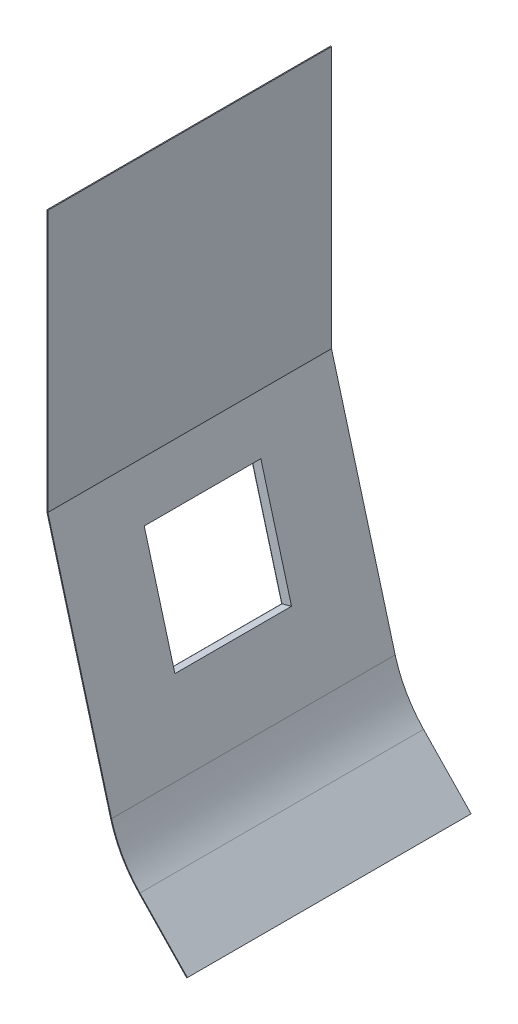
SolidWorks part; units mm, degrees
ref_plane "Front Plane" through (0, 0, 0) normal (0, 0, 1) x (1, 0, 0)
ref_plane "Top Plane" through (0, 0, 0) normal (0, 1, 0) x (1, 0, 0)
ref_plane "Right Plane" through (0, 0, 0) normal (1, 0, 0) x (0, 0, -1)
sketch "Sketch2" plane through (0, 0, 0) normal (0, 0, 1) x (1, 0, 0)
  line L0 (-1955.5772, 1359.5164) -> (-1955.5772, 2592.5164) construction
  line L1 (-1568.9554, 167.6637) -> (-1369.1254, -40.0781)
  line L3 (0, -42.8511) -> (-1372.0082, -42.8511) construction
  line L4 (-1955.5772, 1359.5164) -> (-1688.0918, 378.98)
  line L5 (-1955.5772, 2458.9806) -> (-1955.5772, 1359.5164)
  line L6 (-1959.5772, 1358.9806) -> (-1955.5772, 1359.5164) construction
  line L7 (-1959.5772, 2458.9806) -> (-1959.5772, 1358.9806)
  line L8 (-1959.5772, 1358.9806) -> (-1691.9508, 377.9273)
  line L9 (-1372.0082, -42.8511) -> (-1571.8382, 164.8907)
  line L10 (-1372.0082, -42.8511) -> (-1369.1254, -40.0781)
  line L11 (-1955.5772, 2458.9806) -> (-1959.5772, 2458.9806)
  line L12 (-1955.5772, 1359.5164) -> (-1959.5772, 1359.5164) construction
  line L13 (-1691.9508, 377.9273) -> (-1688.0918, 378.98) construction
  line L14 (-1571.8382, 164.8907) -> (-1568.9554, 167.6637) construction
  arc A0 (-1688.0918, 378.98) -> (-1568.9554, 167.6637) centre (-1209.5772, 509.5164) ccw
  arc A1 (-1691.9508, 377.9273) -> (-1571.8382, 164.8907) centre (-1209.5772, 509.5165) ccw
  point P0 (0, -40.0781)
  dimension "D2" = 1100
  dimension "D4" = 7.629
  dimension "D7" = 199.83
  dimension "D1" = 4.0357
  dimension "D5" = 4
  dimension "D8" = 500
  dimension "D6" = 28.629
  dimension "D3" = 4
extrude "Boss-Extrude2" add sketch "Sketch2" along normal blind 1192
sketch "Sketch3" plane through (-1478.8057, -403.4107, 0) normal (-0.9647, -0.2632, 0) x (0, 0, 1)
  line L0 (596, 1376.2549) -> (596, 1826.2549) construction
  line L2 (351, 1131.2549) -> (841, 1131.2549)
  line L3 (1192, 1826.2549) -> (0, 1826.2549) construction
  line L4 (351, 1131.2549) -> (351, 1621.2549)
  line L5 (351, 1621.2549) -> (841, 1621.2549)
  line L6 (841, 1131.2549) -> (841, 1621.2549)
  line L7 (351, 1131.2549) -> (841, 1621.2549) construction
  line L8 (351, 1621.2549) -> (841, 1131.2549) construction
  dimension "D1" = 490
  dimension "D2" = 450
extrude "Cut-Extrude1" cut sketch "Sketch3" against normal through all
sketch "Sketch4" plane through (-1478.8057, -403.4107, 0) normal (-0.9647, -0.2632, 0) x (0, 0, 1)
  line L0 (845, 1127.2549) -> (845, 1625.2549)
  line L1 (351, 1131.2549) -> (841, 1131.2549)
  line L2 (351, 1131.2549) -> (351, 1621.2549)
  line L3 (351, 1621.2549) -> (841, 1621.2549)
  line L4 (841, 1131.2549) -> (841, 1621.2549)
  line L5 (351, 1131.2549) -> (841, 1621.2549) construction
  line L6 (351, 1621.2549) -> (841, 1131.2549) construction
  line L7 (347, 1625.2549) -> (845, 1625.2549)
  line L8 (347, 1127.2549) -> (347, 1625.2549)
  line L9 (347, 1127.2549) -> (845, 1127.2549)
  point P0 (596, 1376.2549)
  point P5 (0, 0)
  dimension "D1" = 4
extrude "Boss-Extrude4" add sketch "Sketch4" along normal blind 42
sketch "Sketch19" plane through (-1519.3251, -414.4642, 0) normal (-0.9647, -0.2632, 0) x (0, 0, 1)
  line L0 (316, 1656.2549) -> (876, 1656.2549)
  line L1 (351, 1131.2549) -> (841, 1131.2549)
  line L2 (351, 1131.2549) -> (351, 1621.2549)
  line L3 (351, 1621.2549) -> (841, 1621.2549)
  line L4 (841, 1131.2549) -> (841, 1621.2549)
  line L5 (351, 1131.2549) -> (841, 1621.2549) construction
  line L6 (351, 1621.2549) -> (841, 1131.2549) construction
  line L7 (876, 1096.2549) -> (876, 1656.2549)
  line L8 (316, 1096.2549) -> (876, 1096.2549)
  line L9 (316, 1096.2549) -> (316, 1656.2549)
  point P0 (596, 1376.2549)
  point P5 (351, 1081.2549)
  dimension "D1" = 35
extrude "Boss-Extrude5" add sketch "Sketch19" against normal blind 4
fillet "Fillet1" radius 5 4 edges at (-1817.0467, 676.9108, 596) (-1881.5254, 913.2739, 351) (-1881.5254, 913.2739, 841) (-1946.004, 1149.637, 596)
fillet "Fillet2" radius 1 4 edges at (-1943.1978, 1154.5487, 596) (-1877.6664, 914.3266, 347) (-1812.135, 674.1046, 596) (-1877.6664, 914.3266, 845)
fillet "Fillet3" radius 35 4 edges at (-1953.2858, 1183.9295, 316) (-1953.2858, 1183.9295, 876) (-1805.906, 643.671, 876) (-1805.906, 643.671, 316)
sketch "Sketch20" plane through (-1519.3251, -414.4642, 0) normal (-0.9647, -0.2632, 0) x (0, 0, 1)
  line L0 (351, 1096.2549) -> (841, 1096.2549) construction
  line L1 (776, 1111.2549) -> (776, 1641.2549) construction
  line L2 (841, 1656.2549) -> (351, 1656.2549) construction
  circle A0 centre (776, 1111.2549) radius 6
  circle A1 centre (776, 1641.2549) radius 6
  point P4 (596, 1096.2549)
  dimension "D1" = 12
  dimension "D2" = 15
  dimension "D3" = 180
  dimension "D5" = 15
extrude "Cut-Extrude2" cut sketch "Sketch20" against normal blind 4
sketch "Sketch21" plane through (-1519.3251, -414.4642, 0) normal (-0.9647, -0.2632, 0) x (0, 0, 1)
  line L0 (861, 1196.2549) -> (331, 1196.2549) construction
  line L1 (876, 1131.2549) -> (876, 1621.2549) construction
  line L2 (316, 1621.2549) -> (316, 1131.2549) construction
  circle A0 centre (861, 1196.2549) radius 6
  circle A1 centre (331, 1196.2549) radius 6
  point P8 (876, 1376.2549)
  dimension "D1" = 12
  dimension "D2" = 15
  dimension "D3" = 15
  dimension "D4" = 180
extrude "Cut-Extrude3" cut sketch "Sketch21" against normal blind 4 contours A0 | A1
pattern_linear "LPattern1" count 4 spacing 120 along (0, 0, -1) of "Cut-Extrude2"
pattern_linear "LPattern2" count 4 spacing 120 along (-0.2632, 0.9647, 0) of "Cut-Extrude3"
